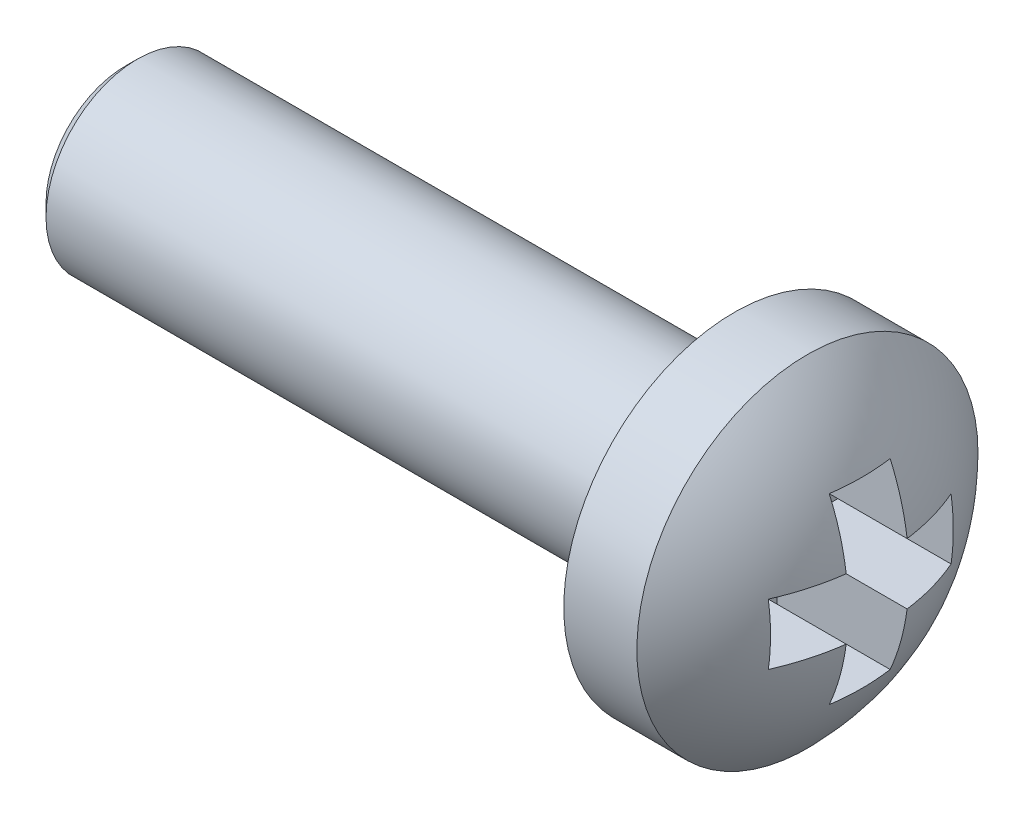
SolidWorks part; units mm, degrees
ref_plane "Plan de face" through (0, 0, 0) normal (0, 0, 1) x (1, 0, 0)
ref_plane "Plan de dessus" through (0, 0, 0) normal (0, 1, 0) x (1, 0, 0)
ref_plane "Plan de droite" through (0, 0, 0) normal (1, 0, 0) x (0, 0, -1)
sketch "Esquisse1" plane through (0, 0, 0) normal (0, 0, 1) x (1, 0, 0)
  line L0 (11.0618, 0) -> (-32.4908, 0) construction
  line L1 (0, 1.5) -> (0, 2.8)
  line L2 (0, 2.8) -> (1.2, 2.8)
  line L3 (0, 1.5) -> (-10, 1.5)
  line L4 (-10, 1.5) -> (-10, 0)
  line L5 (2.4, -1.2574) -> (2.4, 1.2574) construction
  line L6 (2.4, 0) -> (-10, 0)
  spline S0 degree 2 poles (1.2, 2.8) (2.4, 1.5717) (2.4, 0) knots 0 0 0 1 1 1
  dimension "D1" = 1.5
  dimension "D2" = 10
  dimension "D3" = 2.8
  dimension "D4" = 1.2
  dimension "D5" = 2.4
revolve "Révolution1" add sketch "Esquisse1" angle 360 about L0
chamfer "Chanfrein1" distance 0.2 angle 45 1 edges at (-10, 0, -1.5)
sketch "Esquisse2" plane through (0, 0, 0) normal (-1, 0, 0) x (0, 0, 1)
  line L0 (-0.5, 0.5) -> (-1.5, 0.5)
  line L1 (0.5, 1.5) -> (-0.5, 1.5)
  line L2 (0.5, 1.5) -> (0.5, 0.5)
  line L3 (0.5, -1.5) -> (-0.5, -1.5)
  line L4 (-0.5, 1.5) -> (-0.5, 0.5)
  line L5 (1.5, 0.5) -> (0.5, 0.5)
  line L6 (1.5, 0.5) -> (1.5, -0.5)
  line L7 (1.5, -0.5) -> (0.5, -0.5)
  line L8 (-1.5, 0.5) -> (-1.5, -0.5)
  line L9 (0.5, -0.5) -> (0.5, -1.5)
  line L10 (-0.5, -0.5) -> (-1.5, -0.5)
  line L11 (-0.5, -0.5) -> (-0.5, -1.5)
  dimension "D1" = 1
  dimension "D2" = 3
  dimension "D3" = 1.5
  dimension "D4" = 1.5
extrude "Enlèv. mat.-Extru.1" cut sketch "Esquisse2" along normal blind 2.2 from offset 2.4
